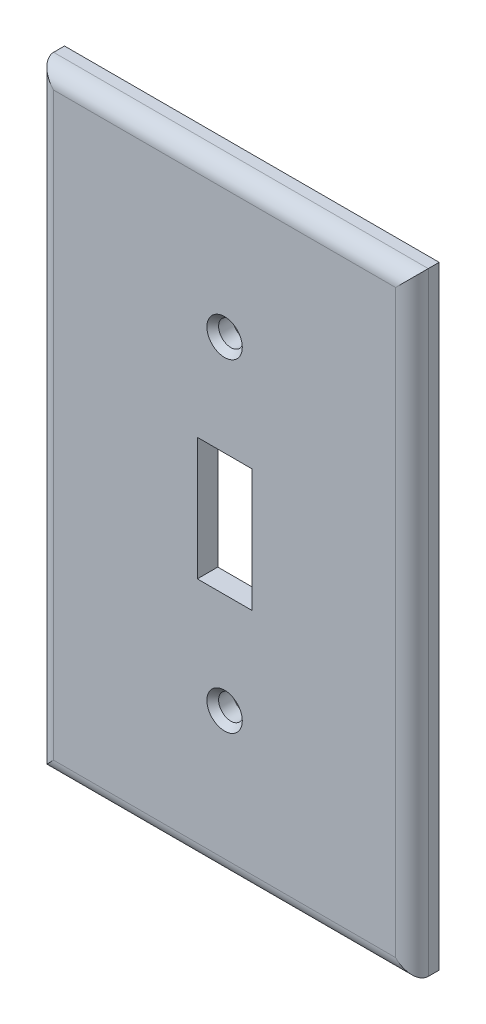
SolidWorks part; units mm, degrees
ref_plane "Front Plane" through (0, 0, 0) normal (0, 0, 1) x (1, 0, 0)
ref_plane "Top Plane" through (0, 0, 0) normal (0, 1, 0) x (1, 0, 0)
ref_plane "Right Plane" through (0, 0, 0) normal (1, 0, 0) x (0, 0, -1)
sketch "Sketch1" plane through (0, 0, 0) normal (0, 0, 1) x (1, 0, 0)
  line L1 (-34.925, 57.15) -> (34.925, 57.15)
  line L2 (-34.925, 57.15) -> (-34.925, -57.15)
  line L3 (-34.925, -57.15) -> (34.925, -57.15)
  line L4 (34.925, 57.15) -> (34.925, -57.15)
  line L5 (-5.08, 11.43) -> (5.08, 11.43)
  line L6 (-5.08, 11.43) -> (-5.08, -11.43)
  line L7 (-5.08, -11.43) -> (5.08, -11.43)
  line L8 (5.08, 11.43) -> (5.08, -11.43)
  point P4 (-34.925, 0)
  point P6 (0, 57.15)
  point P11 (0, 11.43)
  point P12 (-5.08, 0)
  dimension "D1" = 69.85
  dimension "D2" = 114.3
  dimension "D3" = 22.86
  dimension "D4" = 10.16
extrude "Boss-Extrude1" add sketch "Sketch1" along normal blind 5.08
sketch "Sketch2" plane through (0, 0, 5.08) normal (0, 0, 1) x (1, 0, 0)
  point P0 (0, 0)
  point P1 (0, 30.1625)
  point P3 (0, 0)
  point P4 (0, -30.1625)
  dimension "D1" = 60.325
  dimension "D2" = 30.1625
hole_wizard "CSK for #6 Flat Head Socket Cap Screw1" positions "Sketch3" profile "Sketch5" countersink size "#6" standard "ANSI Inch"
sketch "Sketch3" plane through (0, 0, 5.08) normal (0, 0, 1) x (1, 0, 0)
  point P0 (0, 30.1625)
  point P3 (0, -30.1625)
sketch "Sketch5" plane through (0, 30.1625, 5.08) normal (1, 0, 0) x (0, -1, 0)
  line L0 (0, 0) -> (0, 5.08)
  line L1 (0, 5.08) -> (2.286, 5.08)
  line L2 (2.286, 5.08) -> (2.286, 1.1688)
  line L3 (2.286, 1.1688) -> (3.302, 0)
  line L5 (3.302, 0) -> (0, 0)
  line L6 (-2.286, 1.1688) -> (-3.302, 0) construction
  line L11 (0, -6.35) -> (0, 107.95) construction
  dimension "Thru Hole Dia." = 4.572
  dimension "Thru Hole Depth" = 5.08
  dimension "Near C'Sink Dia." = 6.604
  dimension "Near C'Sink Angle" = 82
fillet "Fillet1" radius 3.048 4 edges at (0, 57.15, 5.08) (34.925, 0, 5.08) (0, -57.15, 5.08) (-34.925, 0, 5.08)
shell "Shell1" thickness 2.54
sketch "Sketch6" plane through (0, 0, 0) normal (0, 0, -1) x (-1, 0, 0)
  line L0 (-7.62, -13.97) -> (-7.62, 13.97) construction
  line L1 (-7.62, 34.9885) -> (7.62, 34.9885)
  line L2 (-7.62, 34.9885) -> (-7.62, -34.9885)
  line L3 (-7.62, -34.9885) -> (7.62, -34.9885)
  line L4 (7.62, 34.9885) -> (7.62, -34.9885)
  circle A0 centre (0, 30.1625) radius 4.826 construction
  point P4 (0, 34.9885)
  point P6 (-7.62, 0)
extrude "Cut-Extrude1" cut sketch "Sketch6" against normal blind 1.27
